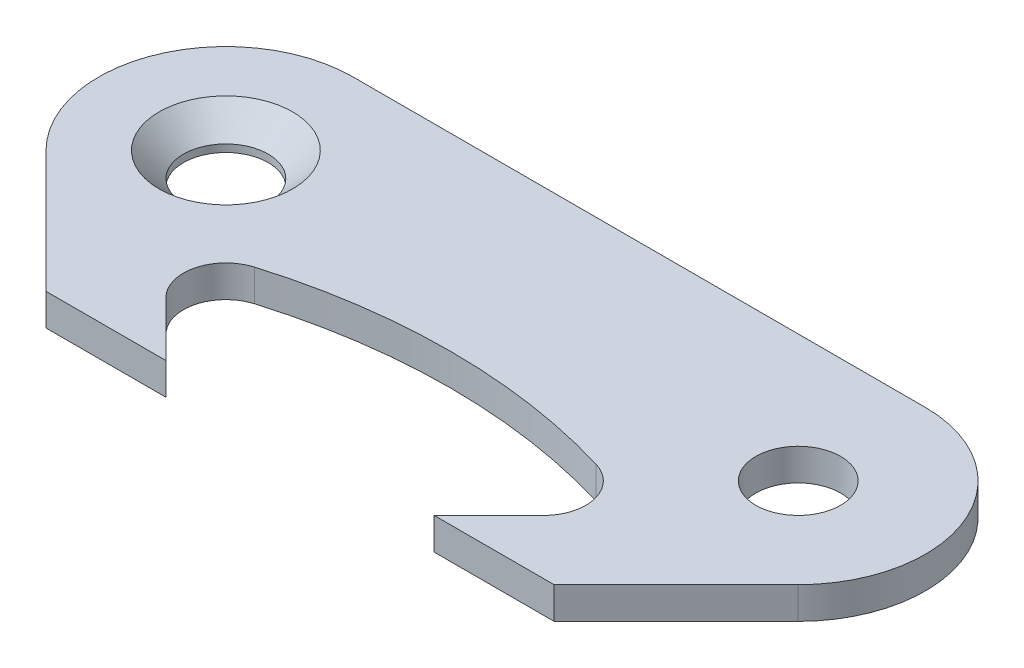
SolidWorks part; units mm, degrees
ref_plane "Front Plane" through (0, 0, 0) normal (0, 0, 1) x (1, 0, 0)
ref_plane "Top Plane" through (0, 0, 0) normal (0, 1, 0) x (1, 0, 0)
ref_plane "Right Plane" through (0, 0, 0) normal (1, 0, 0) x (0, 0, -1)
sketch "Sketch1" plane through (0, 0, 0) normal (0, 1, 0) x (1, 0, 0)
  line L0 (0, 0) -> (54, 0) construction
  line L1 (0, 12) -> (54, 12)
  line L2 (0, 0) -> (27, -27) construction
  line L3 (54, 0) -> (27, -27) construction
  line L4 (27, 0) -> (27, -62.4106) construction
  line L5 (62.4853, -8.4853) -> (50.9706, -20)
  line L6 (-8.4853, -8.4853) -> (3.0294, -20)
  line L7 (44.8076, -14.8492) -> (39.6569, -20)
  line L8 (9.1924, -14.8492) -> (14.3431, -20)
  line L9 (3.0294, -20) -> (14.3431, -20)
  line L10 (39.6569, -20) -> (50.9706, -20)
  arc A0 (0, 12) -> (-8.4853, -8.4853) centre (0, 0) ccw
  arc A2 (10.8686, -8.1904) -> (9.1924, -14.8492) centre (12.0208, -12.0208) ccw
  arc A3 (44.8076, -14.8492) -> (43.1314, -8.1904) centre (41.9792, -12.0208) ccw
  arc A4 (43.1314, -8.1904) -> (10.8686, -8.1904) centre (27, -61.8166) ccw
  circle A5 centre (54, 0) radius 4
  circle A6 centre (0, 0) radius 4
  arc A7 (62.4853, -8.4853) -> (54, 12) centre (54, 0) ccw
  dimension "D2" = 12
  dimension "D5" = 8
  dimension "D6" = 8
  dimension "D7" = 17
  dimension "D8" = 54
  dimension "D9" = 8
  dimension "D10" = 8
  dimension "D11" = 56
  dimension "D3" = 45
  dimension "D4" = 90
  dimension "D12" = 20
extrude "Extrude1" add sketch "Sketch1" along normal blind 3
sketch "Sketch2" plane through (0, 3, 0) normal (0, 1, 0) x (1, 0, 0)
  point P0 (0, 0)
hole_wizard "CSK for M6 Countersunk Flat Head Screw1" positions "3DSketch1" profile "Sketch4" countersink size "M6" standard "ISO"
sketch3d "3DSketch1"
  point P0 (0, 3, 0)
sketch "Sketch4" plane through (0, 3, 0) normal (1, 0, 0) x (0, 0, 1)
  line L0 (0, 0) -> (0, 3)
  line L1 (0, 3) -> (4, 3)
  line L2 (4, 3) -> (4, 2.3)
  line L3 (4, 2.3) -> (6.3, 0)
  line L5 (6.3, 0) -> (0, 0)
  line L6 (-4, 2.3) -> (-6.3, 0) construction
  line L11 (0, -6.35) -> (0, 107.95) construction
  dimension "Thru Hole Dia." = 8
  dimension "Thru Hole Depth" = 3
  dimension "Near C'Sink Dia." = 12.6
  dimension "Near C'Sink Angle" = 90
